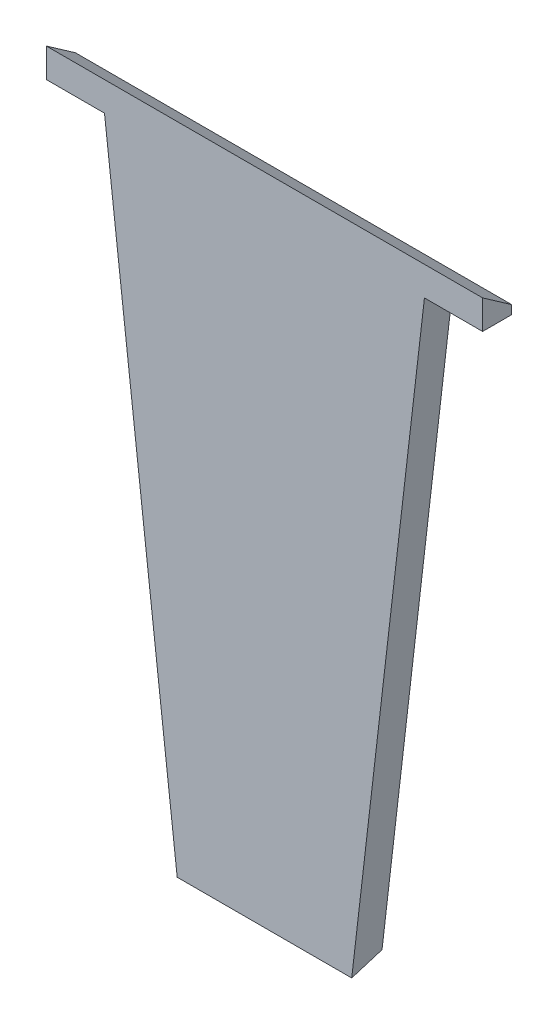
SolidWorks part; units mm, degrees
ref_plane "Plan de face" through (0, 0, 0) normal (0, 0, 1) x (1, 0, 0)
ref_plane "Plan de dessus" through (0, 0, 0) normal (0, 1, 0) x (1, 0, 0)
ref_plane "Plan de droite" through (0, 0, 0) normal (1, 0, 0) x (0, 0, -1)
sketch "Esquisse1" plane through (0, 0, 0) normal (0, 0, 1) x (1, 0, 0)
  line L0 (0, 0) -> (120, 0)
  line L1 (120, 0) -> (170, 430)
  line L2 (170, 430) -> (210, 430)
  line L3 (210, 430) -> (210, 450)
  line L4 (210, 450) -> (-90, 450)
  line L5 (-90, 450) -> (-90, 430)
  line L6 (-90, 430) -> (-50, 430)
  line L7 (-50, 430) -> (0, 0)
  line L8 (60, 0) -> (60, 450) construction
  dimension "D1" = 300
  dimension "D2" = 20
  dimension "D3" = 450
  dimension "D4" = 40
  dimension "D5" = 120
extrude "Boss.-Extru.1" add sketch "Esquisse1" along normal mid plane 20
sketch "Esquisse2" plane through (210, 0, 0) normal (1, 0, 0) x (0, 0, -1)
  line L0 (-10, 450) -> (10, 435.9958)
  line L1 (10, 430) -> (10, 450) construction
  line L2 (10, 435.9958) -> (10, 450)
  line L3 (10, 450) -> (-10, 450)
  dimension "D1" = 35
extrude "Enlèv. mat.-Extru.1" cut sketch "Esquisse2" against normal up to next
sketch "Esquisse3" plane through (0, 0, 0) normal (1, 0, 0) x (0, 0, -1)
  line L0 (-10, 0) -> (10, 7.2794)
  line L1 (10, 0) -> (10, 430) construction
  line L2 (10, 7.2794) -> (10, 0)
  line L3 (10, 0) -> (-10, 0)
  dimension "D1" = 20
extrude "Enlèv. mat.-Extru.2" cut sketch "Esquisse3" against normal up to next and the other way up to next
